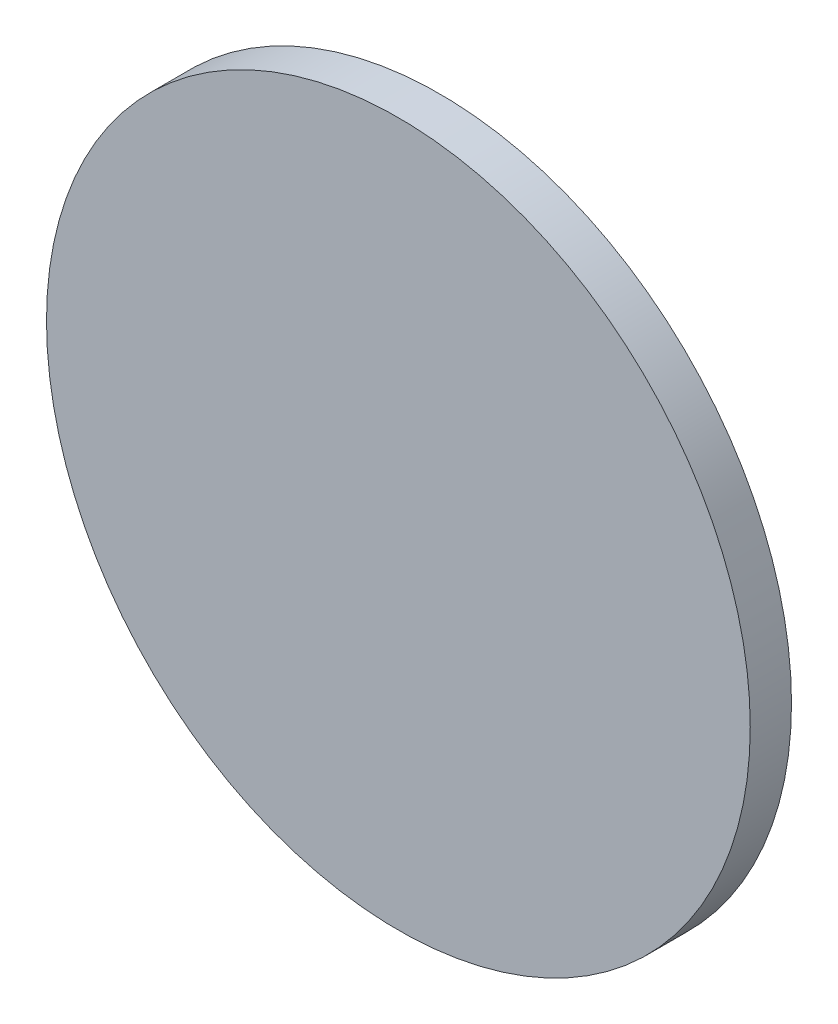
SolidWorks part; units mm, degrees
ref_plane "Plane1" through (0, 0, 0) normal (0, 0, 1) x (1, 0, 0)
ref_plane "Plane2" through (0, 0, 0) normal (0, 1, 0) x (1, 0, 0)
ref_plane "Plane3" through (0, 0, 0) normal (1, 0, 0) x (0, 0, -1)
sketch "Sketch1" plane through (0, 0, 0) normal (0, 0, 1) x (1, 0, 0)
  circle A0 centre (0, 0) radius 30.988
extrude "Base-Extrude" add sketch "Sketch1" along normal blind 3.6322
